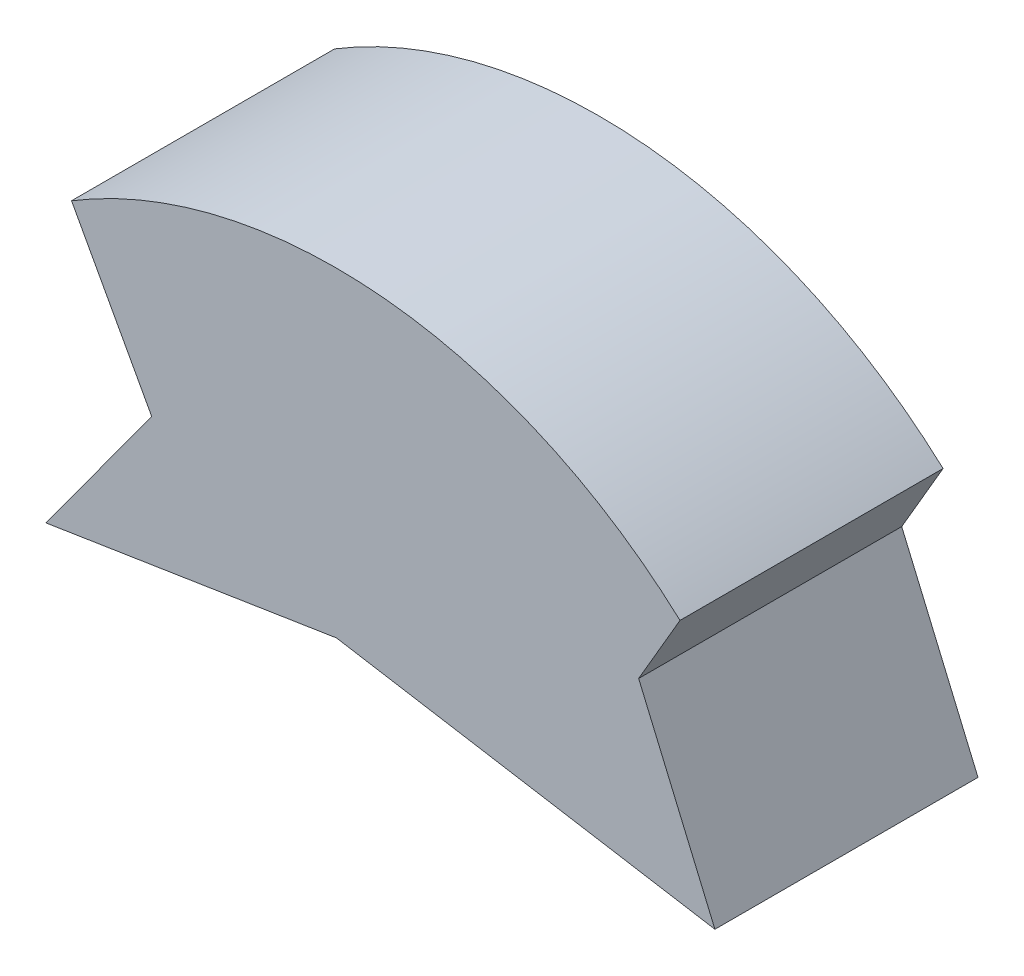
SolidWorks part; units mm, degrees
ref_plane "Plan1" through (0, 0, 0) normal (0, 0, 1) x (1, 0, 0)
ref_plane "Plan2" through (0, 0, 0) normal (0, 1, 0) x (1, 0, 0)
ref_plane "Plan3" through (0, 0, 0) normal (1, 0, 0) x (0, 0, -1)
sketch "Esquisse1" plane through (0, 0, 0) normal (0, 0, 1) x (1, 0, 0)
  line L0 (-274.303, -32.837) -> (-251.2816, -36.6739) construction
  line L1 (-251.2816, -36.6739) -> (-255.9207, -25.7832) construction
  line L2 (-255.9207, -25.7832) -> (-253.4056, -21.4654) construction
  line L3 (-290.4122, -17.8665) -> (-285.538, -26.7884) construction
  line L4 (-285.538, -26.7884) -> (-291.9655, -35.6125) construction
  line L5 (-291.9655, -35.6125) -> (-274.303, -32.837) construction
  line L6 (-274.303, -32.837) -> (-251.2816, -36.6739)
  line L7 (-251.2816, -36.6739) -> (-255.9207, -25.7832)
  line L8 (-255.9207, -25.7832) -> (-253.4056, -21.4654)
  line L9 (-290.4122, -17.8665) -> (-285.538, -26.7884)
  line L10 (-285.538, -26.7884) -> (-291.9655, -35.6125)
  line L11 (-291.9655, -35.6125) -> (-274.303, -32.837)
  arc A0 (-253.4056, -21.4654) -> (-290.4122, -17.8665) centre (-274.3101, -44.3565) ccw construction
  arc A1 (-253.4056, -21.4654) -> (-290.4122, -17.8665) centre (-274.3101, -44.3565) ccw
extrude "Base-Extrusion" add sketch "Esquisse1" along normal mid plane 16
